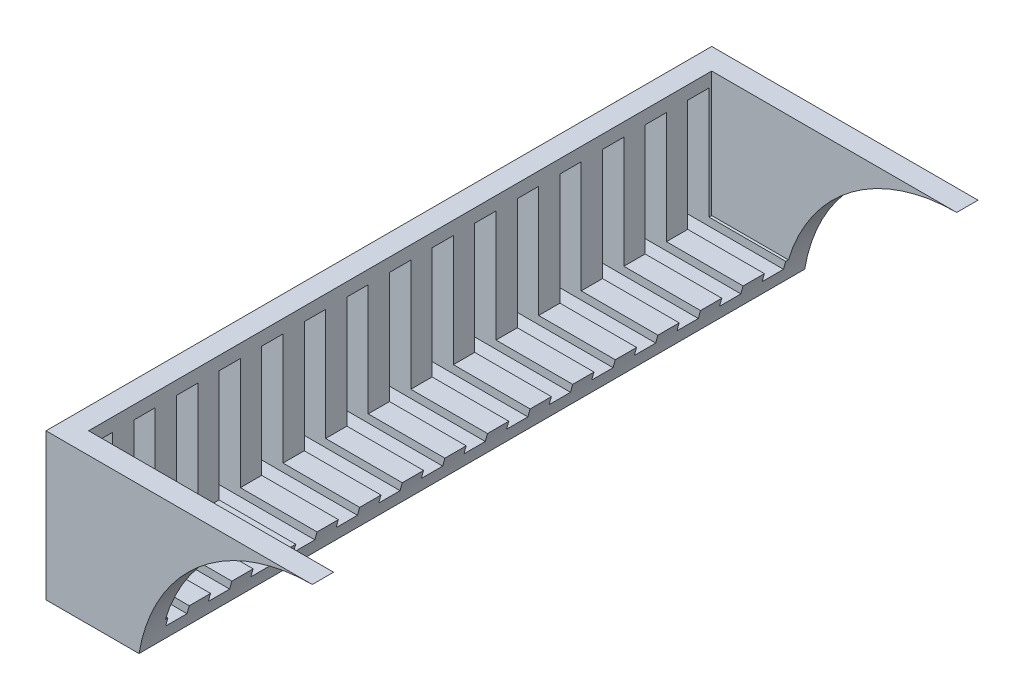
SolidWorks part; units mm, degrees
ref_plane "Front Plane" through (0, 0, 0) normal (0, 0, 1) x (1, 0, 0)
ref_plane "Top Plane" through (0, 0, 0) normal (0, 1, 0) x (1, 0, 0)
ref_plane "Right Plane" through (0, 0, 0) normal (1, 0, 0) x (0, 0, -1)
sketch "Sketch1" plane through (0, 0, 0) normal (0, 0, 1) x (1, 0, 0)
  line L0 (0, 0) -> (127, 0)
  line L1 (127, 0) -> (127, 69.85)
  line L2 (127, 69.85) -> (0, 69.85)
  line L3 (0, 69.85) -> (0, 0)
  dimension "D1" = 127
  dimension "D2" = 69.85
extrude "Boss-Extrude1" add sketch "Sketch1" against normal blind 317.5
sketch "Sketch2" plane through (0, 69.85, 0) normal (0, 1, 0) x (1, 0, 0)
  line L0 (127, 307.34) -> (10.16, 307.34)
  line L1 (127, 317.5) -> (127, 0) construction
  line L2 (10.16, 307.34) -> (10.16, 10.16)
  line L3 (10.16, 10.16) -> (127, 10.16)
  line L4 (127, 317.5) -> (0, 317.5) construction
  line L5 (127, 0) -> (0, 0) construction
  line L6 (0, 317.5) -> (0, 0) construction
  line L7 (127, 307.34) -> (127, 10.16)
  dimension "D1" = 10.16
  dimension "D2" = 10.16
  dimension "D3" = 10.16
extrude "Cut-Extrude1" cut sketch "Sketch2" against normal offset from surface (59.69 mm away) 10.16
sketch "Sketch4" plane through (0, 0, 0) normal (0, 0, 1) x (1, 0, 0)
  line L0 (127, 0) -> (44.3524, 0)
  line L1 (127, 0) -> (127, 69.85)
  arc A0 (127, 69.85) -> (44.3524, 0) centre (127, -13.97) ccw
  dimension "D1" = 83.82
  dimension "D2" = 82.6476
extrude "Cut-Extrude3" cut sketch "Sketch4" against normal through all
sketch "Sketch5" plane through (0, 0, 0) normal (-1, 0, 0) x (0, 0, 1)
  line L0 (-306.07, 63.5) -> (-306.07, 6.35)
  line L1 (-317.5, 69.85) -> (0, 69.85) construction
  line L2 (-317.5, 0) -> (0, 0) construction
  line L3 (-317.5, 69.85) -> (-317.5, 0) construction
  line L4 (-295.91, 63.5) -> (-295.91, 6.35)
  line L5 (-285.75, 63.5) -> (-285.75, 6.35)
  line L6 (-275.59, 63.5) -> (-275.59, 6.35)
  line L7 (-265.43, 63.5) -> (-265.43, 6.35)
  line L8 (-255.27, 63.5) -> (-255.27, 6.35)
  line L9 (-245.11, 63.5) -> (-245.11, 6.35)
  line L10 (-234.95, 63.5) -> (-234.95, 6.35)
  line L11 (-224.79, 63.5) -> (-224.79, 6.35)
  line L12 (-214.63, 63.5) -> (-214.63, 6.35)
  line L13 (-204.47, 63.5) -> (-204.47, 6.35)
  line L14 (-194.31, 63.5) -> (-194.31, 6.35)
  line L15 (-184.15, 63.5) -> (-184.15, 6.35)
  line L16 (-173.99, 63.5) -> (-173.99, 6.35)
  line L17 (-163.83, 63.5) -> (-163.83, 6.35)
  line L18 (-153.67, 63.5) -> (-153.67, 6.35)
  line L19 (-143.51, 63.5) -> (-143.51, 6.35)
  line L20 (-133.35, 63.5) -> (-133.35, 6.35)
  line L21 (-123.19, 63.5) -> (-123.19, 6.35)
  line L22 (-113.03, 63.5) -> (-113.03, 6.35)
  line L23 (-102.87, 63.5) -> (-102.87, 6.35)
  line L24 (-92.71, 63.5) -> (-92.71, 6.35)
  line L25 (-82.55, 63.5) -> (-82.55, 6.35)
  line L26 (-72.39, 63.5) -> (-72.39, 6.35)
  line L27 (-62.23, 63.5) -> (-62.23, 6.35)
  line L28 (-52.07, 63.5) -> (-52.07, 6.35)
  line L29 (-41.91, 63.5) -> (-41.91, 6.35)
  line L30 (-31.75, 63.5) -> (-31.75, 6.35)
  line L31 (-21.59, 63.5) -> (-21.59, 6.35)
  line L32 (-11.43, 63.5) -> (-11.43, 6.35)
  line L33 (-306.07, 63.5) -> (-295.91, 63.5)
  line L34 (-275.59, 6.35) -> (-285.75, 6.35)
  line L35 (-11.43, 6.35) -> (-21.59, 6.35)
  line L37 (-285.75, 63.5) -> (-275.59, 63.5)
  line L38 (-295.91, 6.35) -> (-306.07, 6.35)
  line L39 (-265.43, 63.5) -> (-255.27, 63.5)
  line L40 (-255.27, 6.35) -> (-265.43, 6.35)
  line L41 (-245.11, 63.5) -> (-234.95, 63.5)
  line L42 (-234.95, 6.35) -> (-245.11, 6.35)
  line L43 (-224.79, 63.5) -> (-214.63, 63.5)
  line L44 (-204.47, 63.5) -> (-194.31, 63.5)
  line L45 (-214.63, 6.35) -> (-224.79, 6.35)
  line L46 (-194.31, 6.35) -> (-204.47, 6.35)
  line L47 (-184.15, 63.5) -> (-173.99, 63.5)
  line L48 (-173.99, 6.35) -> (-184.15, 6.35)
  line L49 (-163.83, 63.5) -> (-153.67, 63.5)
  line L50 (-153.67, 6.35) -> (-163.83, 6.35)
  line L51 (-143.51, 63.5) -> (-133.35, 63.5)
  line L52 (-133.35, 6.35) -> (-143.51, 6.35)
  line L53 (-123.19, 63.5) -> (-113.03, 63.5)
  line L54 (-113.03, 6.35) -> (-123.19, 6.35)
  line L55 (-102.87, 63.5) -> (-92.71, 63.5)
  line L56 (-92.71, 6.35) -> (-102.87, 6.35)
  line L57 (-82.55, 63.5) -> (-72.39, 63.5)
  line L58 (-72.39, 6.35) -> (-82.55, 6.35)
  line L59 (-62.23, 63.5) -> (-52.07, 63.5)
  line L60 (-52.07, 6.35) -> (-62.23, 6.35)
  line L61 (-41.91, 63.5) -> (-31.75, 63.5)
  line L62 (-31.75, 6.35) -> (-41.91, 6.35)
  line L63 (-21.59, 63.5) -> (-11.43, 63.5)
  dimension "D1" = 6.35
  dimension "D2" = 6.35
  dimension "D3" = 11.43
  dimension "D4" = 10.16
  dimension "D5" = 30
extrude "Cut-Extrude4" cut sketch "Sketch5" against normal up to surface (94.997 mm away)
